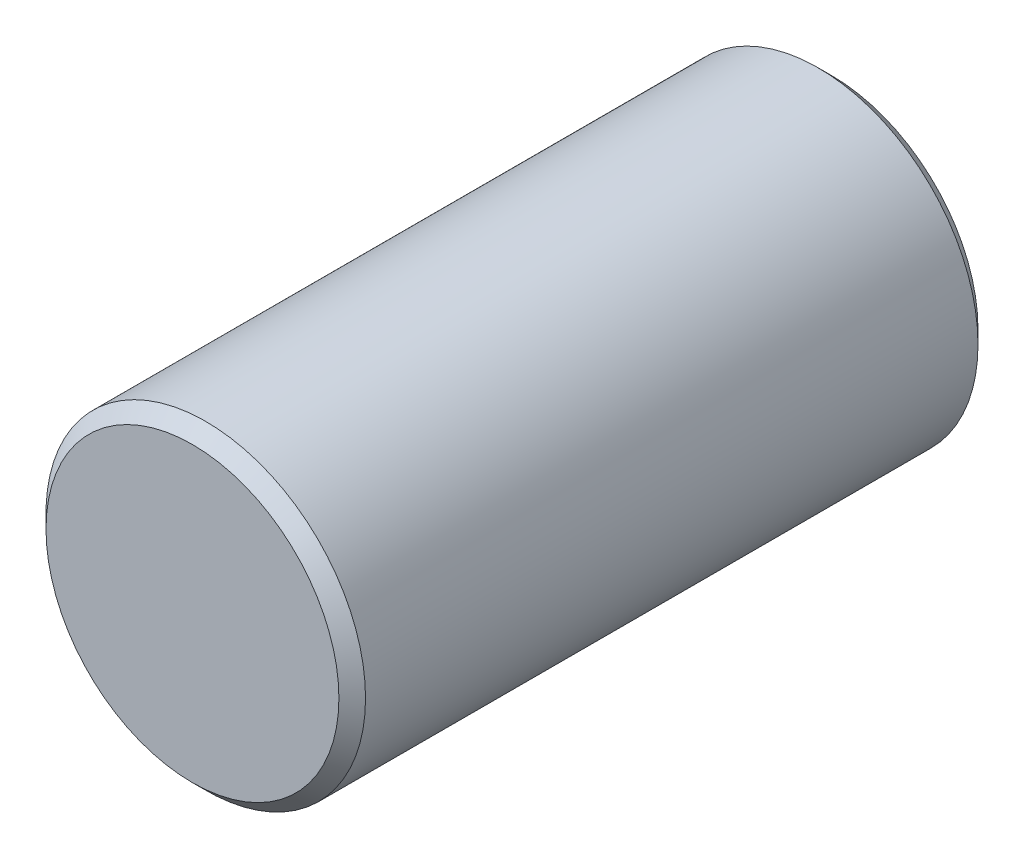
SolidWorks part; units mm, degrees
ref_plane "Front Plane" through (0, 0, 0) normal (0, 0, 1) x (1, 0, 0)
ref_plane "Top Plane" through (0, 0, 0) normal (0, 1, 0) x (1, 0, 0)
ref_plane "Right Plane" through (0, 0, 0) normal (1, 0, 0) x (0, 0, -1)
sketch "Sketch1" plane through (0, 0, 0) normal (1, 0, 0) x (0, 0, -1)
  line L0 (10.6747, 0) -> (50010.6747, 0) construction
  line L1 (0, 0) -> (12, 0)
  line L6 (0.25, 3) -> (0, 2.75)
  line L7 (0, 2.75) -> (0, 0)
  line L8 (11.75, 3) -> (0.25, 3)
  line L9 (12, 2.75) -> (11.75, 3)
  line L10 (12, 0) -> (12, 2.75)
  dimension "D1" = 45
  dimension "D2" = 45
  dimension "D3" = 12
  dimension "D4" = 0.25
  dimension "D5" = 6
revolve "Revolve1" add sketch "Sketch1" angle 360 about L0
